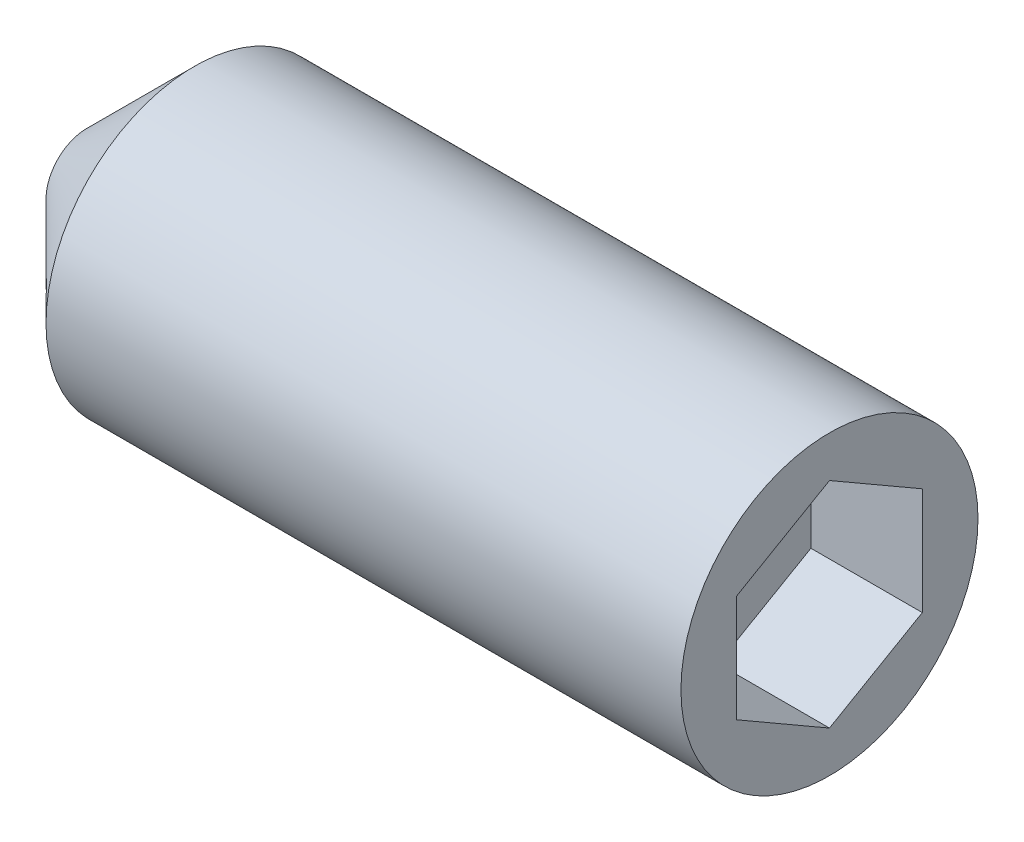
SolidWorks part; units mm, degrees
ref_plane "Ebene vorne" through (0, 0, 0) normal (0, 0, 1) x (1, 0, 0)
ref_plane "Ebene oben" through (0, 0, 0) normal (0, 1, 0) x (1, 0, 0)
ref_plane "Ebene rechts" through (0, 0, 0) normal (1, 0, 0) x (0, 0, -1)
sketch "Skizze1" plane through (0, 0, 0) normal (0, 0, 1) x (1, 0, 0)
  line L0 (0, 0) -> (27.9922, 0) construction
  line L1 (0, 0) -> (0, 1.1)
  line L2 (0, 1.1) -> (2.9, 4)
  line L3 (2.9, 4) -> (20, 4)
  line L4 (20, 4) -> (20, 0)
  line L5 (20, 0) -> (0, 0)
  point P3 (-1.1, 0)
  dimension "D1" = 45
  dimension "D2" = 8
  dimension "D3" = 2.2
  dimension "D4" = 20
revolve "Rotation1" add sketch "Skizze1" angle 360 about L5
sketch "Skizze2" plane through (20, 0, 0) normal (1, 0, 0) x (0, 0, -1)
  line L1 (-2.5, -1.4434) -> (0, -2.8868)
  line L2 (0, -2.8868) -> (2.5, -1.4434)
  line L3 (2.5, -1.4434) -> (2.5, 1.4434)
  line L4 (2.5, 1.4434) -> (0, 2.8868)
  line L5 (0, 2.8868) -> (-2.5, 1.4434)
  line L6 (-2.5, 1.4434) -> (-2.5, -1.4434)
  circle A0 centre (0, 0) radius 2.5 construction
  dimension "D1" = 5
extrude "Schnitt-Linear austragen1" cut sketch "Skizze2" against normal blind 3
